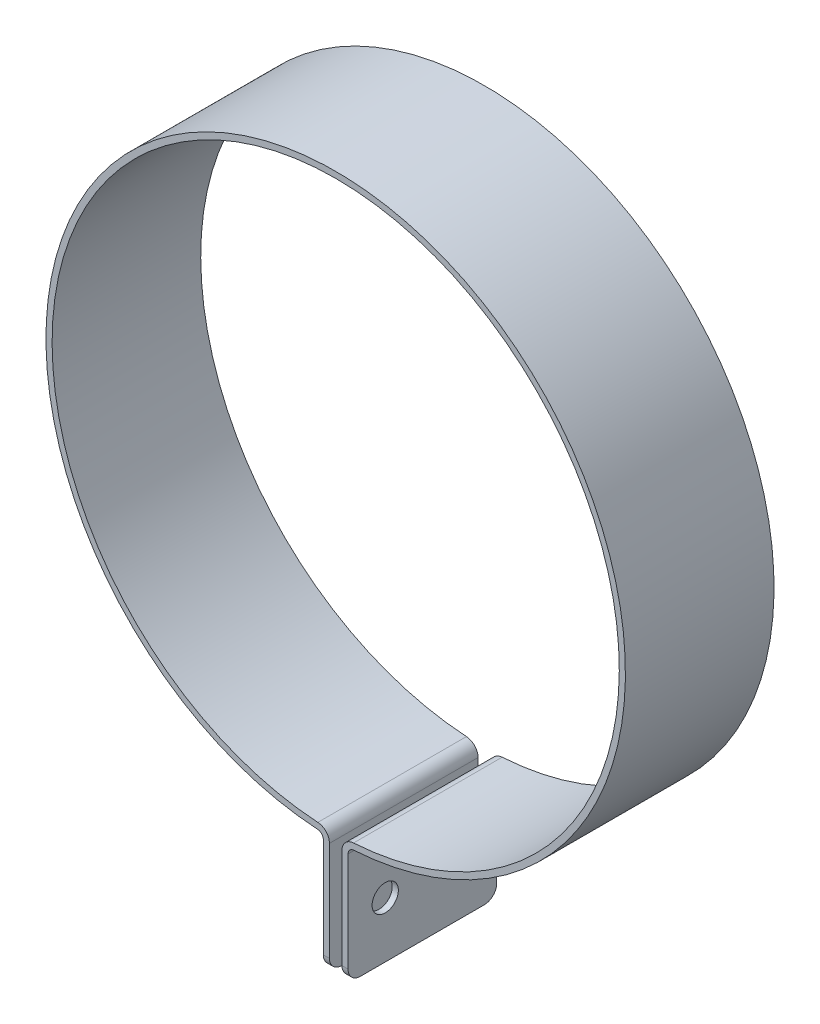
SolidWorks part; units mm, degrees
ref_plane "Front Plane" through (0, 0, 0) normal (0, 0, 1) x (1, 0, 0)
ref_plane "Top Plane" through (0, 0, 0) normal (0, 1, 0) x (1, 0, 0)
ref_plane "Right Plane" through (0, 0, 0) normal (1, 0, 0) x (0, 0, -1)
sketch "Sketch1" plane through (0, 0, 0) normal (0, 0, 1) x (1, 0, 0)
  circle A0 centre (0, 0) radius 72.7075
  circle A1 centre (0, 0) radius 74.2823
  dimension "D1" = 145.415
  dimension "D2" = 1.5748
extrude "Boss-Extrude1" add sketch "Sketch1" against normal blind 38.1
sketch "Sketch2" plane through (0, 0, 0) normal (0, 0, 1) x (1, 0, 0)
  line L1 (-3.175, -104.4575) -> (3.175, -104.4575)
  line L2 (-3.175, -104.4575) -> (-3.175, -72.7075)
  line L3 (-3.175, -72.7075) -> (3.175, -72.7075)
  line L4 (3.175, -104.4575) -> (3.175, -72.7075)
  circle A0 centre (0, 0) radius 72.7075 construction
  dimension "D1" = 3.175
  dimension "D2" = 3.175
  dimension "D3" = 31.75
extrude "Boss-Extrude2" add sketch "Sketch2" against normal blind 38.1
sketch "Sketch3" plane through (0, 0, 0) normal (0, 0, 1) x (1, 0, 0)
  line L0 (-3.175, -74.2144) -> (-3.175, -104.4575) construction
  line L1 (-1.6002, -110.8075) -> (1.6002, -110.8075)
  line L2 (-1.6002, -110.8075) -> (-1.6002, -66.3575)
  line L3 (-1.6002, -66.3575) -> (1.6002, -66.3575)
  line L4 (1.6002, -110.8075) -> (1.6002, -66.3575)
  line L5 (3.175, -104.4575) -> (3.175, -74.2144) construction
  line L6 (-3.175, -104.4575) -> (3.175, -104.4575) construction
  dimension "D1" = 1.5748
  dimension "D2" = 1.5748
  dimension "D3" = 6.35
  dimension "D4" = 44.45
extrude "Cut-Extrude1" cut sketch "Sketch3" against normal through all
fillet "Fillet1" radius 1.5748 2 edges at (-3.175, -74.2144, -19.05) (3.175, -74.2144, -19.05)
fillet "Fillet2" radius 3.175 6 edges at (-1.6002, -72.6899, -19.05) (1.6002, -72.6899, -19.05) (2.3876, -104.4575, -38.1) (2.3876, -104.4575, 0) (-2.3876, -104.4575, 0) (-2.3876, -104.4575, -38.1)
sketch "Sketch4" plane through (3.175, 0, 0) normal (1, 0, 0) x (0, 0, -1)
  line L0 (34.925, -104.4575) -> (3.175, -104.4575) construction
  line L1 (0, -101.2825) -> (0, -75.7082) construction
  line L2 (38.1, -101.2825) -> (38.1, -75.7082) construction
  circle A0 centre (9.525, -90.1827) radius 3.3655
  circle A1 centre (28.575, -90.1827) radius 3.3655
  dimension "D1" = 6.731
  dimension "D2" = 6.731
  dimension "D3" = 14.2748
  dimension "D4" = 14.2748
  dimension "D5" = 9.525
  dimension "D6" = 9.525
extrude "Cut-Extrude2" cut sketch "Sketch4" against normal through all
